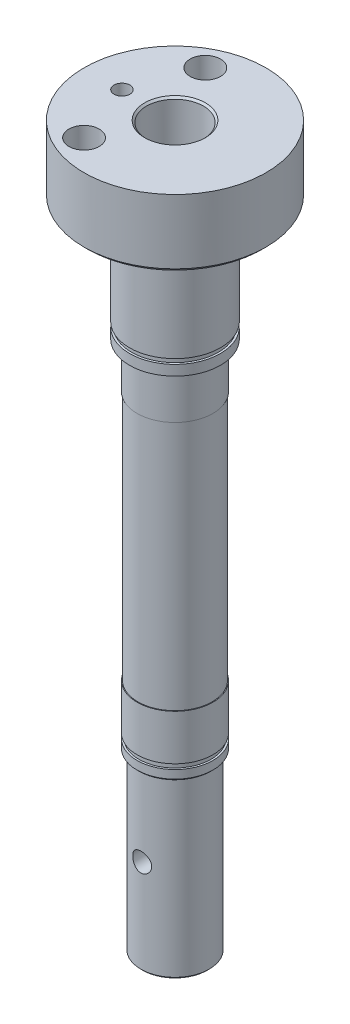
SolidWorks part; units mm, degrees
ref_plane "Plan1" through (0, 0, 0) normal (0, 0, 1) x (1, 0, 0)
ref_plane "Plan2" through (0, 0, 0) normal (0, 1, 0) x (1, 0, 0)
ref_plane "Plan3" through (0, 0, 0) normal (1, 0, 0) x (0, 0, -1)
sketch "Esquisse1" plane through (0, 0, 0) normal (0, 0, 1) x (1, 0, 0)
  line L0 (0, 0) -> (0, 202.4782) construction
  line L1 (0, 190) -> (24, 190)
  line L2 (24, 190) -> (24, 172)
  line L3 (24, 172) -> (12, 172)
  line L4 (10, 46) -> (9, 46)
  line L8 (12, 172) -> (12, 140)
  line L10 (12, 140) -> (10, 140)
  line L11 (10, 140) -> (10, 128)
  line L12 (10, 128) -> (9.8, 128)
  line L13 (9.8, 128) -> (9.8, 62)
  line L14 (9.8, 62) -> (10, 62)
  line L15 (10, 62) -> (10, 46)
  line L21 (9, 46) -> (9, 0)
  line L22 (9, 0) -> (0, 0)
  line L25 (0, 190) -> (0, 0)
  dimension "D1" = 190
  dimension "D2" = 24
  dimension "D3" = 10
  dimension "D4" = 9.8
  dimension "D5" = 12
  dimension "D6" = 18
  dimension "D7" = 10
  dimension "D8" = 9
  dimension "D9" = 50
  dimension "D10" = 12
  dimension "D11" = 66
  dimension "D12" = 144
revolve "Base-Révolution" add sketch "Esquisse1" angle 360 about L0
sketch "Esquisse2" plane through (0, 0, 0) normal (0, 0, 1) x (1, 0, 0)
  line L0 (0, 0) -> (0, 197.0682) construction
  line L1 (0, 0) -> (0, 202.4782) construction
  line L2 (12, 142.7) -> (11.45, 142.7)
  line L3 (12, 142.7) -> (12, 144)
  line L4 (11.45, 144) -> (12, 144)
  line L5 (11.45, 144) -> (11.45, 142.7)
  line L6 (-24, 172) -> (24, 172) construction
  line L7 (10, 50) -> (9.5, 50)
  line L8 (10, 50) -> (10, 48.7)
  line L9 (9.5, 48.7) -> (10, 48.7)
  line L10 (9.5, 48.7) -> (9.5, 50)
  line L11 (24, 190) -> (-24, 190) construction
  dimension "D1" = 12
  dimension "D2" = 11.45
  dimension "D3" = 28
  dimension "D4" = 1.3
  dimension "D5" = 10
  dimension "D6" = 1.3
  dimension "D7" = 140
  dimension "D8" = 9.5
revolve "Enlever de la matière-Révolution1" cut sketch "Esquisse2" angle 360 about L0
other "Perçage2"
sketch "Esquisse4" plane through (0, 190, 0) normal (0, 1, 0) x (-1, 0, 0)
  line L0 (0, 0) -> (0, -26.3014) construction
  line L1 (0, 0) -> (28.6651, 0) construction
  circle A0 centre (8, -16) radius 4
  dimension "D1" = 8
  dimension "D2" = 8
  dimension "D3" = 16
sketch "Esquisse8" plane through (0, 0, 0) normal (0, 0, 1) x (1, 0, 0)
  line L1 (-10, 46) -> (10, 46) construction
  line L2 (0, 25) -> (0, 0) construction
  circle A0 centre (0, 25) radius 2.5
  dimension "D1" = 5
  dimension "D2" = 21
extrude "Enlèv. mat.-Extru.1" cut sketch "Esquisse8" against normal mid plane 20
chamfer "Chanfrein1" distance 0.5 angle 45
chamfer "Chanfrein2" distance 1 angle 45
pattern_linear "Répétition linéaire1" count 2 spacing 32
hole_wizard "Trou taraudé M5x0.81" positions "Esquisse10" profile "Esquisse9" tap size "M5x0.8" standard "Ansi Métrique"
sketch "Esquisse10" plane through (0, 190, 0) normal (0, 1, 0) x (-1, 0, 0)
  line L0 (14, 0) -> (0, 0) construction
  point P0 (14, 0)
  dimension "D1" = 14
sketch "Esquisse9" plane through (-14, 190, 0) normal (1, 0, 0) x (0, 0, 1)
  line L0 (0, 0) -> (0, 190)
  line L1 (0, 190) -> (2.1, 190)
  line L2 (2.1, 190) -> (2.1, 0)
  line L5 (2.1, 0) -> (0, 0)
  line L11 (0, -6.35) -> (0, 107.95) construction
  dimension "Diamètre du trou pour taraudage jusqu'au prochain" = 4.2
  dimension "Profondeur du trou pour taraudage jusqu'au prochain" = 190
hole_wizard "Dégagement pour M61" positions "Esquisse12" profile "Esquisse11" hole size "M6" standard "ISO"
sketch "Esquisse12" plane through (0, 190, 0) normal (0, 1, 0) x (-1, 0, 0)
  circle A0 centre (0, 0) radius 23 construction
  point P0 (0, 0)
sketch "Esquisse11" plane through (0, 190, 0) normal (1, 0, 0) x (0, 0, 1)
  line L0 (0, 0) -> (0, 46.5065)
  line L1 (0, 46.5065) -> (7.5, 42)
  line L2 (7.5, 42) -> (7.5, 0)
  line L5 (7.5, 0) -> (0, 0)
  line L10 (0, 46.5065) -> (-7.5, 42) construction
  line L11 (0, -6.35) -> (0, 107.95) construction
  dimension "Diamètre du perçage" = 15
  dimension "Profondeur du perçage" = 42
  dimension "Angle de pointe" = 118
chamfer "Chanfrein3" distance 0.5 angle 45
